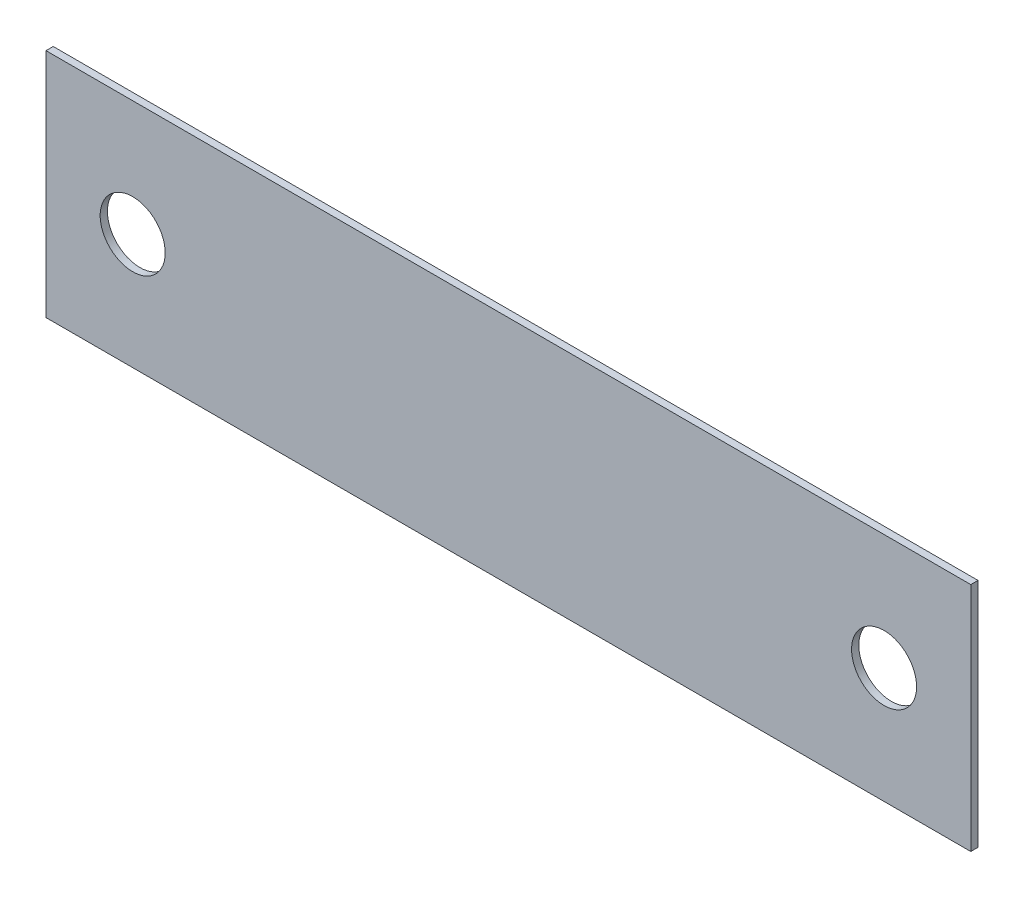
SolidWorks part; units mm, degrees
ref_plane "Front Plane" through (0, 0, 0) normal (1, 0, 0) x (0, 1, 0)
ref_plane "Top Plane" through (0, 0, 0) normal (0, 0, 1) x (0, 1, 0)
ref_plane "Right Plane" through (0, 0, 0) normal (0, 1, 0) x (-1, 0, 0)
sketch "Sketch1" plane through (0, 0, 0) normal (0, 0, 1) x (0, 1, 0)
  line L1 (-25.4, 101.6) -> (25.4, 101.6)
  line L2 (-25.4, 101.6) -> (-25.4, -101.6)
  line L3 (-25.4, -101.6) -> (25.4, -101.6)
  line L4 (25.4, 101.6) -> (25.4, -101.6)
  line L5 (-25.4, 101.6) -> (25.4, -101.6) construction
  line L6 (-25.4, -101.6) -> (25.4, 101.6) construction
  point P0 (0, 0)
  dimension "D1" = 50.8
  dimension "D2" = 203.2
extrude "Boss-Extrude1" add sketch "Sketch1" along normal blind 1.5875
sketch "Sketch2" plane through (0, 0, 0) normal (0, 0, 1) x (-1, 0, 0)
  line L0 (-82.55, 0) -> (82.55, 0) construction
  point P2 (0, 0)
  circle B0 centre (-82.55, 0) radius 7.1438
  circle B1 centre (82.55, 0) radius 7.1438
sketch_block_instance "Block1-1"
sketch_block "Block1" parameters "D1"=20.4939, "D2"=19.0707
extrude "Cut-Extrude1" cut sketch "Sketch2" along normal blind 1.5875
